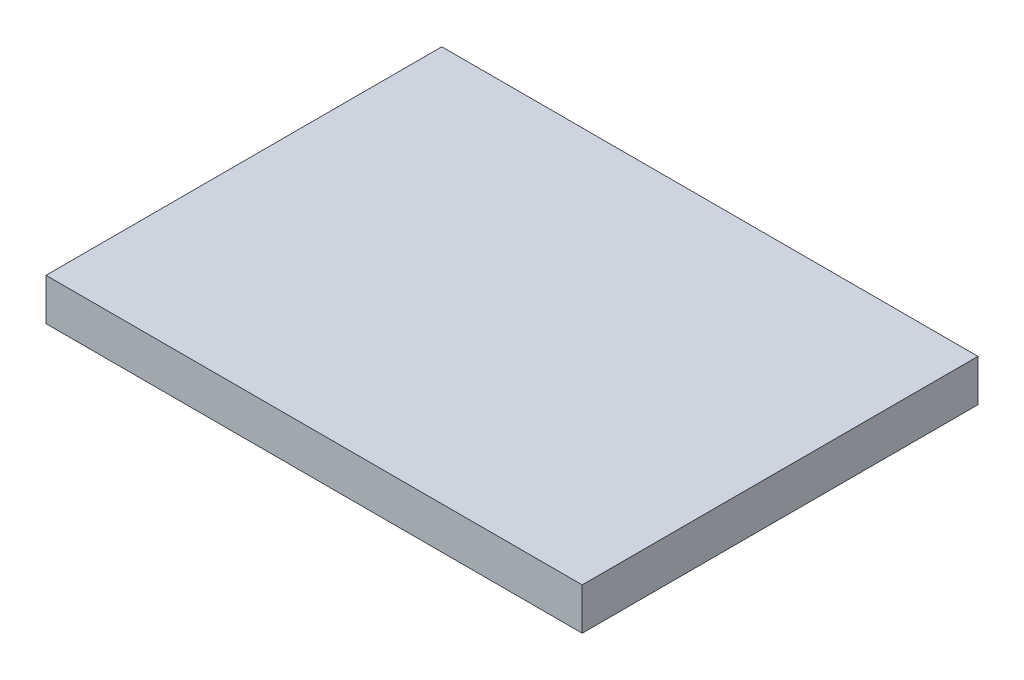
SolidWorks part; units mm, degrees
ref_plane "Front Plane" through (0, 0, 0) normal (0, 0, 1) x (1, 0, 0)
ref_plane "Top Plane" through (0, 0, 0) normal (0, 1, 0) x (1, 0, 0)
ref_plane "Right Plane" through (0, 0, 0) normal (1, 0, 0) x (0, 0, -1)
sketch "Sketch1" plane through (0, 0, 0) normal (0, 1, 0) x (1, 0, 0)
  line L0 (-32, -23.622) -> (-32, 23.622)
  line L1 (-32, 23.622) -> (32, 23.622)
  line L2 (32, 23.622) -> (32, -23.622)
  line L3 (32, -23.622) -> (-32, -23.622)
extrude "Boss-Extrude1" add sketch "Sketch1" along normal blind 5
